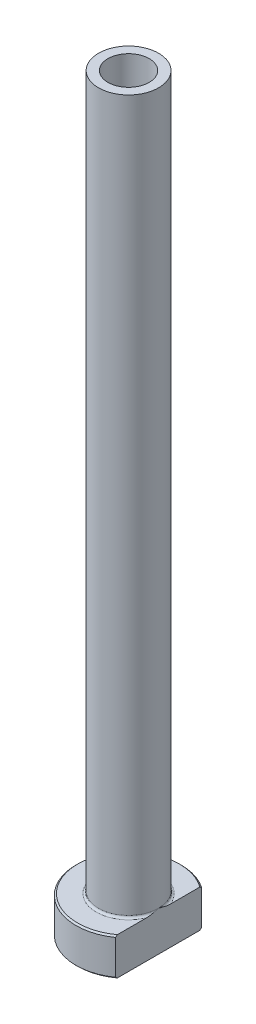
SolidWorks part; units mm, degrees
ref_plane "Front Plane" through (0, 0, 0) normal (0, 0, 1) x (1, 0, 0)
ref_plane "Top Plane" through (0, 0, 0) normal (0, 1, 0) x (1, 0, 0)
ref_plane "Right Plane" through (0, 0, 0) normal (1, 0, 0) x (0, 0, -1)
sketch "Sketch1" plane through (0, 0, 0) normal (0, 0, 1) x (1, 0, 0)
  line L0 (-2.75, 100) -> (-4, 100)
  line L1 (-4, 100) -> (-4, 5)
  line L2 (-4, 5) -> (-7, 5)
  line L3 (-7, 5) -> (-7, 0)
  line L4 (6.05, 0) -> (-6.05, 0) construction
  line L5 (-7, 0) -> (-3, 0)
  line L6 (-2.75, 55) -> (-2.75, 100)
  line L7 (0, 92.1877) -> (0, -15.5353) construction
  line L8 (0, -7.7) -> (0, 7.7) construction
  line L9 (-2.75, 55) -> (-3, 43)
  line L10 (-3, 43) -> (-3, 0)
  dimension "D1" = 0.25
  dimension "ID" = 5.5
  dimension "OD" = 8
  dimension "L" = 100
  dimension "H" = 14
  dimension "T" = 5
  dimension "N" = 45
  dimension "D2" = 12
  dimension "L-N" = 55
revolve "Revolve1" add sketch "Sketch1" angle 360 about L7
fillet "Fillet1" radius 0.3 1 edges at (0, 5, 4)
chamfer "Chamfer1" distance 0.2 angle 45 2 edges at (0, 5, 7) (0, 0, 7)
sketch "Sketch2" plane through (0, 0, 0) normal (0, -1, 0) x (1, 0, 0)
  line L0 (4, 5.7446) -> (4, -5.7446)
  circle A0 centre (0, 0) radius 7 construction
  arc A1 (4, 5.7446) -> (4, -5.7446) centre (0, 0) cw
  circle A2 centre (0, 0) radius 4 construction
extrude "Cut-Extrude1" cut sketch "Sketch2" against normal through all
chamfer "Chamfer2" distance 0.5 angle 45 1 edges at (0, 0, 3)
